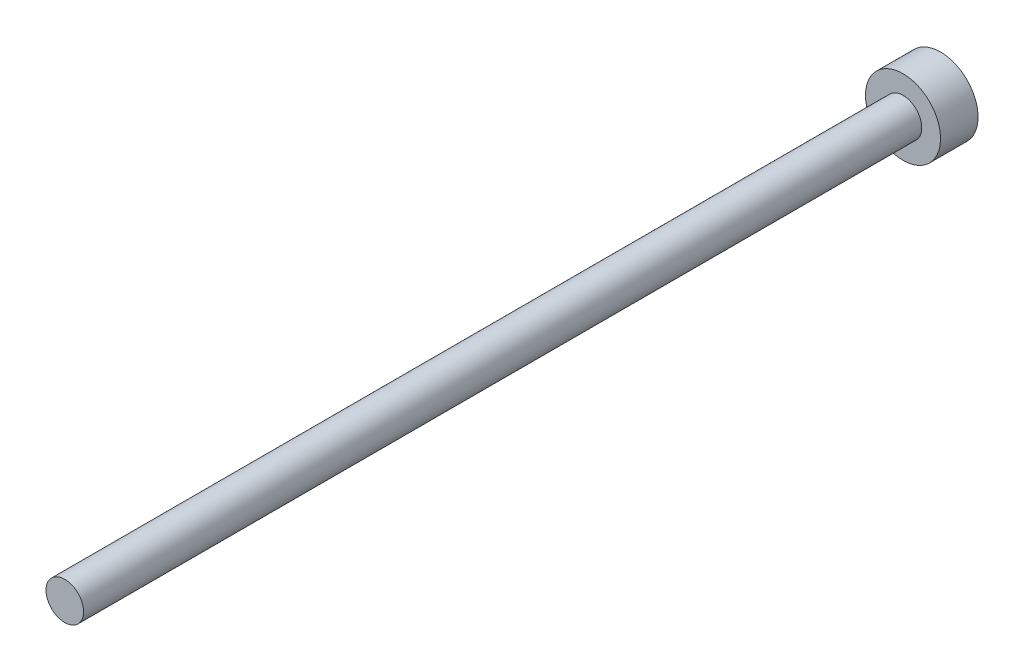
SolidWorks part; units mm, degrees
ref_plane "Plan de face" through (0, 0, 0) normal (0, 0, 1) x (1, 0, 0)
ref_plane "Plan de dessus" through (0, 0, 0) normal (0, 1, 0) x (1, 0, 0)
ref_plane "Plan de droite" through (0, 0, 0) normal (1, 0, 0) x (0, 0, -1)
sketch "Esquisse1" plane through (0, 0, 0) normal (0, 0, 1) x (1, 0, 0)
  circle A0 centre (0, 0) radius 3
  dimension "D1" = 6
extrude "Extrusion1" add sketch "Esquisse1" along normal blind 3
sketch "Esquisse2" plane through (0, 0, 3) normal (0, 0, 1) x (1, 0, 0)
  circle A0 centre (0, 0) radius 1.5
  dimension "D1" = 3
extrude "Extrusion2" add sketch "Esquisse2" along normal blind 67
